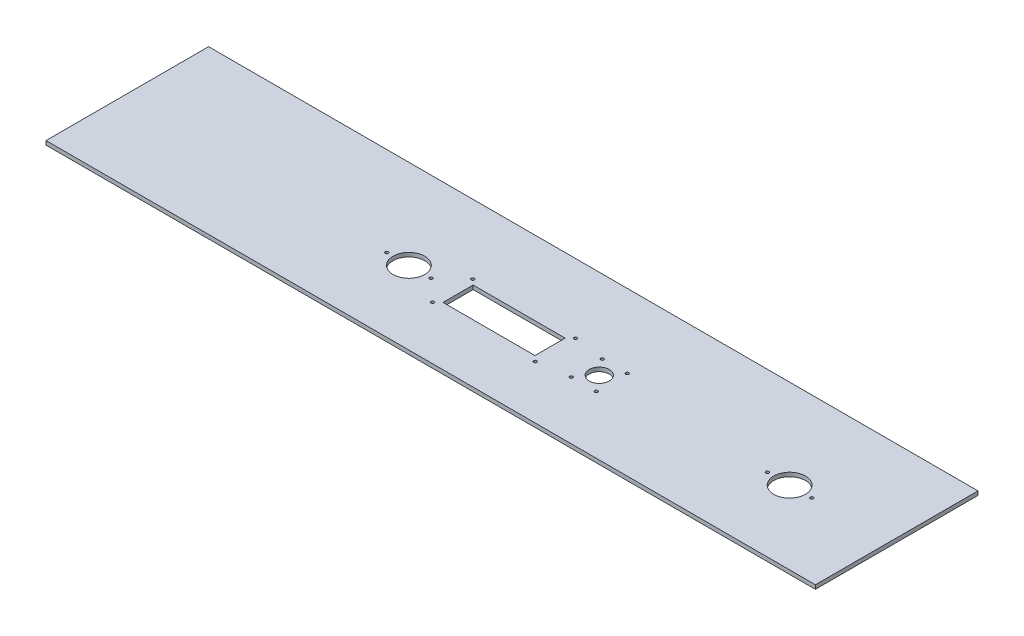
SolidWorks part; units mm, degrees
ref_plane "Front Plane" through (0, 0, 0) normal (0, 0, 1) x (1, 0, 0)
ref_plane "Top Plane" through (0, 0, 0) normal (0, 1, 0) x (1, 0, 0)
ref_plane "Right Plane" through (0, 0, 0) normal (1, 0, 0) x (0, 0, -1)
sketch "Sketch1" plane through (0, 0, 0) normal (0, 1, 0) x (1, 0, 0)
  line L1 (-307.975, -65.0875) -> (307.975, -65.0875)
  line L2 (-307.975, -65.0875) -> (-307.975, 65.0875)
  line L3 (-307.975, 65.0875) -> (307.975, 65.0875)
  line L4 (307.975, -65.0875) -> (307.975, 65.0875)
  line L5 (-307.975, -65.0875) -> (307.975, 65.0875) construction
  line L6 (-307.975, 65.0875) -> (307.975, -65.0875) construction
  point P0 (0, 0)
  dimension "D1" = 130.175
  dimension "D2" = 615.95
extrude "Boss-Extrude1" add sketch "Sketch1" along normal blind 3.175
sketch "Sketch2" plane through (0, 3.175, 0) normal (0, 1, 0) x (1, 0, 0)
  line L0 (0, 65.0875) -> (0, -65.0875) construction
  line L1 (-36.83, -18.415) -> (36.83, -18.415)
  line L2 (-36.83, -18.415) -> (-36.83, 5.715)
  line L3 (-36.83, 5.715) -> (36.83, 5.715)
  line L4 (36.83, -18.415) -> (36.83, 5.715)
  line L5 (-36.83, -18.415) -> (36.83, 5.715) construction
  line L6 (-36.83, 5.715) -> (36.83, -18.415) construction
  line L7 (307.975, 65.0875) -> (-307.975, 65.0875) construction
  line L8 (-307.975, -65.0875) -> (307.975, -65.0875) construction
  line L9 (-43.1, -6.35) -> (43.1, -6.35) construction
  line L10 (-43.1, -25.4) -> (43.1, -25.4) construction
  line L11 (-43.1, -25.4) -> (-43.1, 12.7) construction
  line L12 (-43.1, 12.7) -> (43.1, 12.7) construction
  line L13 (43.1, -25.4) -> (43.1, 12.7) construction
  line L14 (-43.1, -25.4) -> (43.1, 12.7) construction
  line L15 (-43.1, 12.7) -> (43.1, -25.4) construction
  line L16 (76.2, 65.0875) -> (76.2, -65.0875) construction
  line L17 (66.2, -18.85) -> (86.2, -18.85) construction
  line L18 (66.2, -18.85) -> (66.2, 6.15) construction
  line L19 (66.2, 6.15) -> (86.2, 6.15) construction
  line L20 (86.2, -18.85) -> (86.2, 6.15) construction
  line L21 (66.2, -18.85) -> (86.2, 6.15) construction
  line L22 (66.2, 6.15) -> (86.2, -18.85) construction
  circle A0 centre (41.1, 9.7) radius 1.25
  circle A1 centre (41.1, -22.4) radius 1.25
  circle A2 centre (-41.1, -22.4) radius 1.25
  circle A3 centre (-41.1, 9.7) radius 1.25
  circle A4 centre (-76.2, -6.35) radius 12.7
  circle A5 centre (-76.2, -6.35) radius 17.78 construction
  circle A6 centre (-93.98, -6.35) radius 1.25
  circle A7 centre (-58.42, -6.35) radius 1.25
  circle A8 centre (86.2, 6.15) radius 1.25
  circle A9 centre (86.2, -18.85) radius 1.25
  circle A10 centre (66.2, -18.85) radius 1.25
  circle A11 centre (66.2, 6.15) radius 1.25
  circle A12 centre (76.2, -6.35) radius 8
  circle A13 centre (246.38, -6.35) radius 1.25
  circle A14 centre (210.82, -6.35) radius 1.25
  circle A15 centre (228.6, -6.35) radius 12.7
  point P0 (0, -6.35)
  point P15 (0, -6.35)
  point P35 (76.2, -6.35)
  point P44 (76.2, -6.35)
  dimension "D6" = 2.5
  dimension "D9" = 25.4
  dimension "D11" = 35.56
  dimension "D12" = 2.5
  dimension "D13" = 2.5
  dimension "D15" = 2.5
  dimension "D18" = 16
  dimension "D1" = 73.66
  dimension "D2" = 24.13
  dimension "D3" = 6.35
  dimension "D4" = 38.1
  dimension "D5" = 86.2
  dimension "D7" = 2
  dimension "D8" = 3
  dimension "D10" = 76.2
  dimension "D14" = 76.2
  dimension "D16" = 25
  dimension "D17" = 20
  dimension "D19" = 76.2
extrude "Cut-Extrude1" cut sketch "Sketch2" against normal through all
